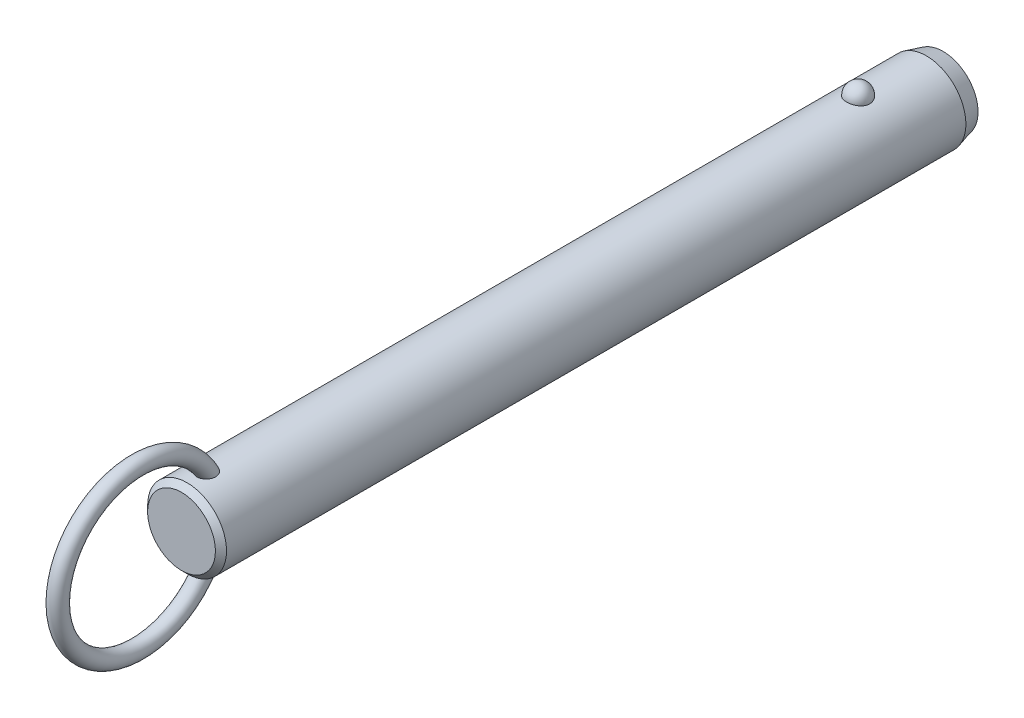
SolidWorks part; units mm, degrees
ref_plane "Front Plane" through (0, 0, 0) normal (0, 0, 1) x (1, 0, 0)
ref_plane "Top Plane" through (0, 0, 0) normal (0, 1, 0) x (1, 0, 0)
ref_plane "Right Plane" through (0, 0, 0) normal (1, 0, 0) x (0, 0, -1)
sketch "Sketch2" plane through (0, 0, 0) normal (0, 0, 1) x (1, 0, 0)
  circle A0 centre (0, 0) radius 7.1
  point P3 (0, 7.1)
  dimension "D1" = 14.2
extrude "Boss-Extrude1" add sketch "Sketch2" along normal blind 111.8
sketch "Sketch3" plane through (0, 0, 0) normal (0, 0, -1) x (-1, 0, 0)
  circle A0 centre (0, 0) radius 7.1
  dimension "D1" = 14.2
extrude "Boss-Extrude2" add sketch "Sketch3" along normal blind 17.4
chamfer "Chamfer1" distance 3 angle 15 1 edges at (-7.1, 0, -17.4)
sketch "Sketch12" plane through (0, 0, 0) normal (1, 0, 0) x (0, 0, -1)
  line L0 (-111.8, 7.1) -> (-111.8, -7.1) construction
  point P0 (-111.8, 0)
sketch "Sketch13" plane through (0, 0, 0) normal (1, 0, 0) x (0, 0, -1)
  circle A0 centre (-127.65, 0) radius 15.85
  point P2 (-111.8, 0)
  dimension "D1" = 31.7
sketch "Sketch14" plane through (0, 0, 0) normal (0, 1, 0) x (1, 0, 0)
  circle A0 centre (0, -113.3) radius 1.5
  point P2 (0, -111.8)
  dimension "D1" = 3
sweep "Sweep1" add profiles "Sketch14" path "Sketch13"
sketch "Sketch15" plane through (0, 0, 111.8) normal (0, 0, 1) x (1, 0, 0)
  circle A0 centre (0, 0) radius 7.1
  dimension "D1" = 14.2
extrude "Boss-Extrude3" add sketch "Sketch15" along normal blind 7.92
chamfer "Chamfer2" distance 1 angle 45 1 edges at (7.1, 0, 119.72)
sketch "Sketch18" plane through (0, 0, 0) normal (1, 0, 0) x (0, 0, -1)
  line L0 (14.4, 7.1) -> (-113.4792, 7.1) construction
  line L1 (2.1, 9.2) -> (2.1, 5)
  line L2 (-113.4792, -7.1) -> (14.4, -7.1) construction
  arc A0 (2.1, 9.2) -> (2.1, 5) centre (2.1, 7.1) ccw
  point P4 (0, 7.1)
  dimension "D1" = 16.3
revolve "Revolve1" add sketch "Sketch18" angle 360 about L1
